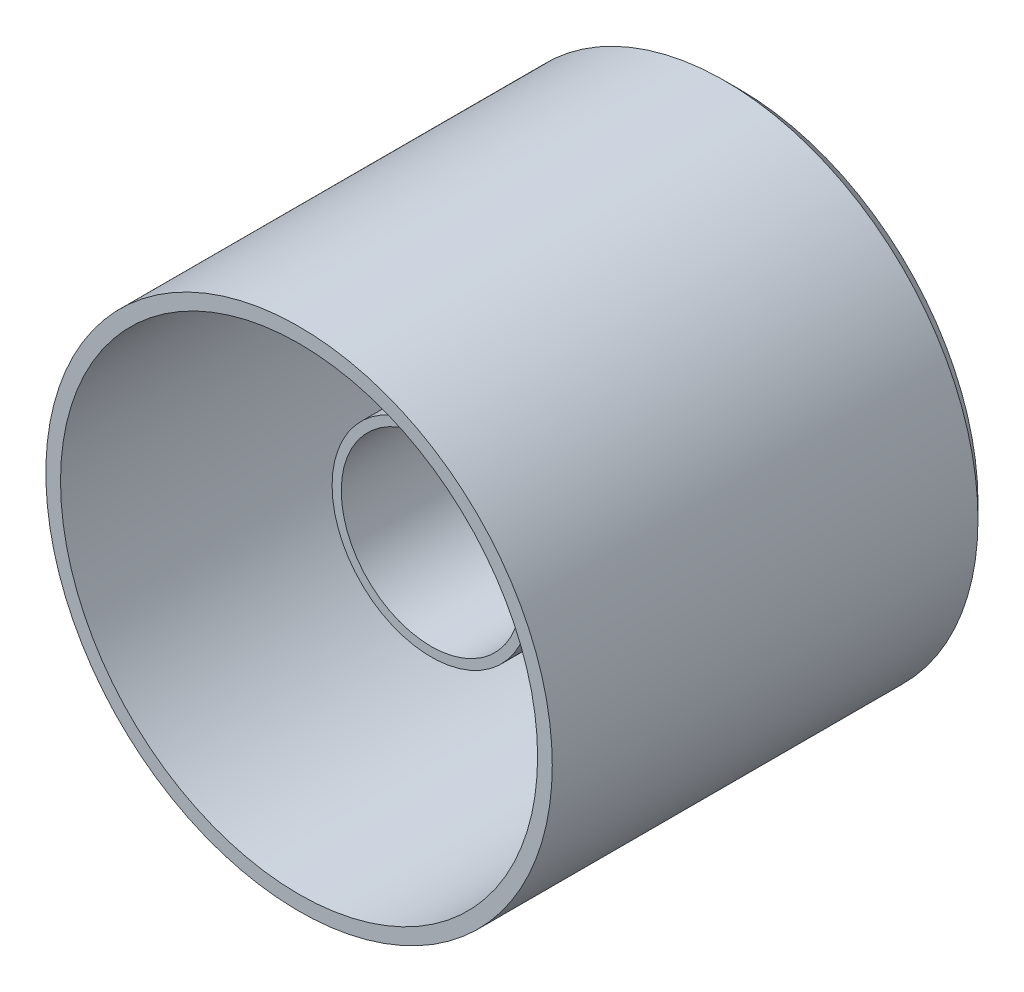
SolidWorks part; units mm, degrees
ref_plane "Plan de face" through (0, 0, 0) normal (0, 0, 1) x (1, 0, 0)
ref_plane "Plan de dessus" through (0, 0, 0) normal (0, 1, 0) x (1, 0, 0)
ref_plane "Plan de droite" through (0, 0, 0) normal (1, 0, 0) x (0, 0, -1)
sketch "Esquisse1" plane through (0, 0, 0) normal (0, 0, 1) x (1, 0, 0)
  circle A0 centre (0, 0) radius 34.5
  dimension "D1" = 69
extrude "Boss.-Extru.1" add sketch "Esquisse1" along normal blind 60
shell "Coque1" thickness 2
chamfer "Chanfrein1" distance 2 angle 45 1 edges at (34.5, 0, 0)
sketch "Esquisse2" plane through (0, 0, 0) normal (0, 0, -1) x (-1, 0, 0)
  circle A0 centre (0, 0) radius 12.25
  dimension "D1" = 24.5
extrude "Enlèv. mat.-Extru.1" cut sketch "Esquisse2" against normal blind 5
sketch "Esquisse3" plane through (0, 0, 2) normal (0, 0, 1) x (1, 0, 0)
  circle A0 centre (0, 0) radius 12.25 construction
  circle A1 centre (0, 0) radius 12.25
  circle A2 centre (0, 0) radius 13.5
  dimension "D1" = 27
extrude "Boss.-Extru.2" add sketch "Esquisse3" along normal blind 40
